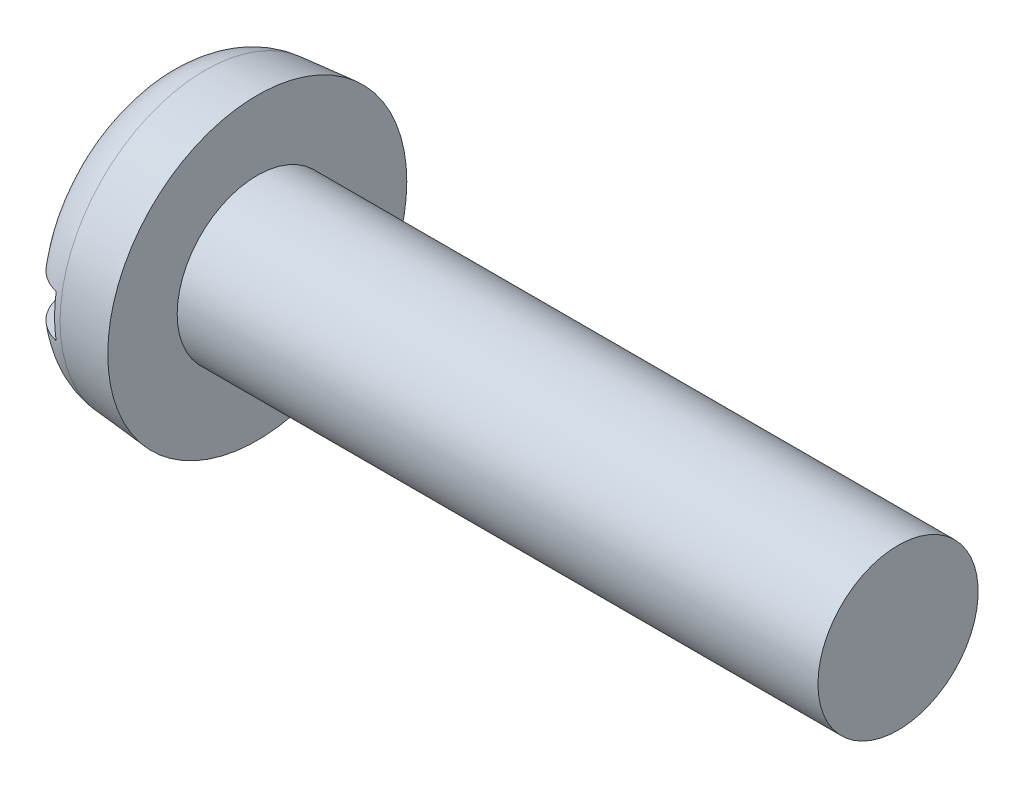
SolidWorks part; units mm, degrees
ref_plane "Plane1" through (0, 0, 0) normal (0, 0, 1) x (1, 0, 0)
ref_plane "Plane2" through (0, 0, 0) normal (0, 1, 0) x (1, 0, 0)
ref_plane "Plane3" through (0, 0, 0) normal (1, 0, 0) x (0, 0, -1)
sketch "BodySke" plane through (0, 0, 0) normal (0, 0, 1) x (1, 0, 0)
  line L0 (1.8, 1.5) -> (1.8, 2.8)
  line L1 (0, 0) -> (0, 2.6425)
  line L2 (-25.4, 0) -> (127, 0) construction
  line L3 (13.8, 0) -> (0, 0)
  line L4 (1.8, 1.5) -> (13.8, 1.5)
  line L5 (13.8, 1.5) -> (13.8, 0)
  line L6 (0, 2.6425) -> (1.8, 2.8)
  line L9 (2.3, 3.0875) -> (2.3, -6.4375) construction
  line L10 (1.8, 6.35) -> (1.8, -3.175) construction
  dimension "Head_ht" = 1.8
  dimension "Diameter" = 3
  dimension "Length" = 12
  dimension "Head_dia" = 5.6
  dimension "Advance" = 0.5
  dimension "Thread_nom" = 12
  dimension "Head_side_angle" = 5
revolve "Base-Revolve" add sketch "BodySke"
fillet "Fillet1" [suppressed] radius 0.1
fillet "Fillet2" radius 0.9 1 edges at (0, 0, 2.6425)
sketch "Sketch2" plane through (0, 0, 0) normal (1, 0, 0) x (0, 0, -1)
  line L0 (2.8, -0.4) -> (-2.8, -0.4)
  line L1 (2.8, -0.4) -> (2.8, 0.4)
  line L2 (-2.8, 0.4) -> (2.8, 0.4)
  line L3 (-2.8, 0.4) -> (-2.8, -0.4)
  dimension "D1" = 5.6
  dimension "D2" = 2.8
  dimension "Slot_width" = 0.8
  dimension "D3" = 0.4
extrude "Slot" cut sketch "Sketch2" along normal blind 0.7
sketch "ThdSchSke" plane through (0, 0, 0) normal (0, 0, 1) x (1, 0, 0)
  line L0 (2.8, -1.2195) -> (2.6036, -1.5)
  line L1 (2.8, -1.2195) -> (2.9964, -1.5)
  line L2 (2.9964, -1.5) -> (2.9964, -1.875)
  line L3 (-3.175, 0) -> (5.1513, 0) construction
  line L5 (2.9964, -1.875) -> (2.6036, -1.875)
  line L6 (2.6036, -1.875) -> (2.6036, -1.5)
  dimension "Thread_minor" = 2.439
  dimension "Diameter" = 3
  dimension "Start" = 2.8
  dimension "SideAngle" = 55
  dimension "VeeAngle" = 70
  dimension "Overcut" = 3.75
revolve "ThreadSchematic" [suppressed] cut sketch "ThdSchSke" angle 360 about L3
pattern_linear "ThdSchPat" [suppressed]
equation "\"D1@Sketch2\" = \"Head_dia@BodySke\""
equation "\"D2@Sketch2\" = \"D1@Sketch2\" / 2"
equation "\"D3@Sketch2\" = \"Slot_width@Sketch2\" / 2"
equation "\"Thread_length@ThreadCosmetic\" = ((sgn( (\"Length@BodySke\" - \"Advance@BodySke\" * 2.0 ) - \"Thread_nom@BodySke\" )-1)*( (\"Length@BodySke\" - \"Advance@BodySke\"  * 2.0) - \"Thread_nom@BodySke\" ))/-2+ \"Thread_"
equation "\"Thread_minor@ThdSchSke\" = \"Thread_minor@ThreadCosmetic\""
equation "\"Diameter@ThdSchSke\" = \"Diameter@BodySke\""
equation "\"Overcut@ThdSchSke\" = \"Diameter@BodySke\" * 1.25"
equation "\"Start@ThdSchSke\" = \"Head_ht@BodySke\" + \"Length@BodySke\" - \"Thread_length@ThreadCosmetic\"  '---Non-countersunk---"
equation "\"Num_threads@ThdSchPat\" = int( \"Thread_length@ThreadCosmetic\" / \"Advance@BodySke\" + 0.999 )  + 1"
equation "\"Advance@ThdSchPat\" = \"Thread_length@ThreadCosmetic\" /  (\"Num_threads@ThdSchPat\" - 1) 'relax it"
